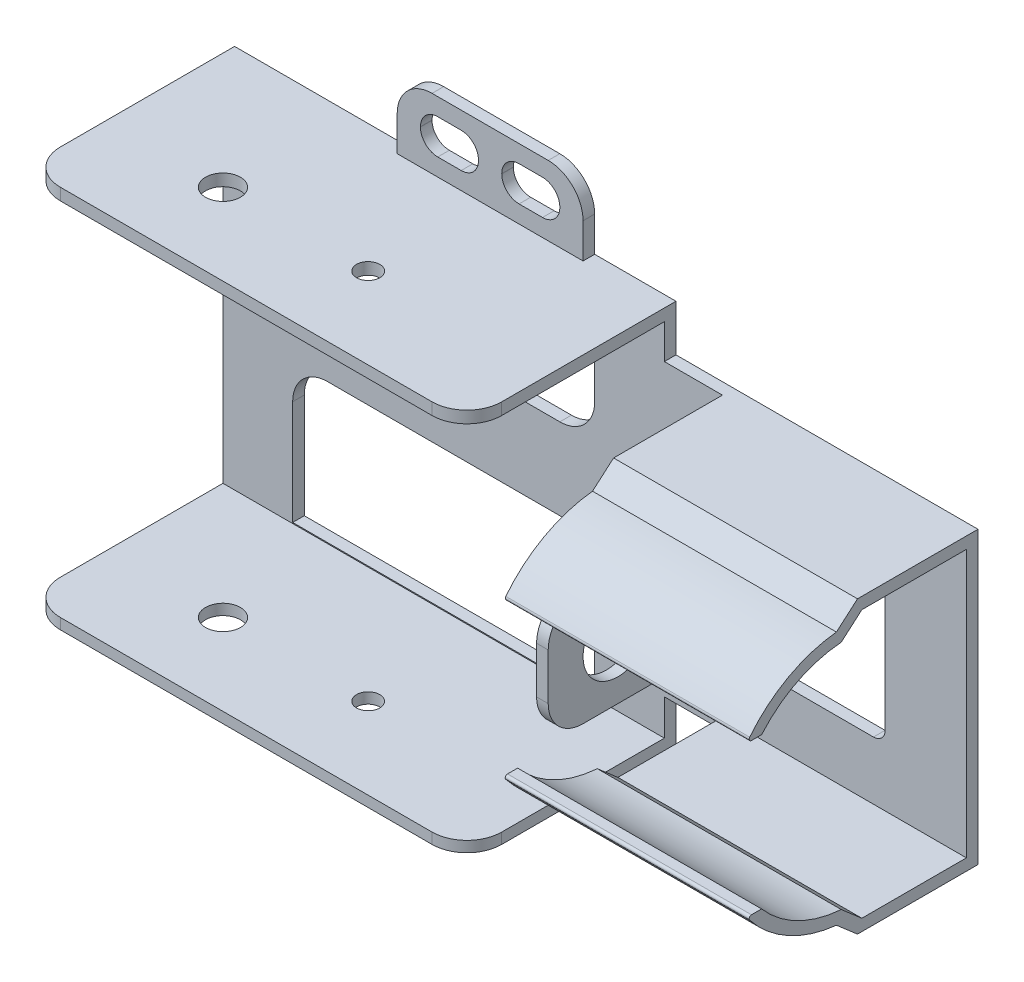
SolidWorks part; units mm, degrees
ref_plane "Plan de face" through (0, 0, 0) normal (0, 0, 1) x (1, 0, 0)
ref_plane "Plan de dessus" through (0, 0, 0) normal (0, 1, 0) x (1, 0, 0)
ref_plane "Plan de droite" through (0, 0, 0) normal (1, 0, 0) x (0, 0, -1)
sketch "Esquisse1" plane through (0, 0, 0) normal (0, 0, 1) x (1, 0, 0)
  line L0 (-30.9892, 6.739) -> (-30.9892, 10.739)
  line L1 (-77.8035, -5.761) -> (7.1636, -5.761) construction
  line L2 (-68.9892, 10.739) -> (-68.9892, -22.261)
  line L3 (-53.9892, 16.739) -> (-37.9892, 16.739)
  line L4 (-4.9892, 6.739) -> (-4.9892, -18.2523)
  line L5 (-30.9892, 6.739) -> (-4.9892, 6.739)
  line L6 (-30.9892, -18.2523) -> (-30.9892, -22.261)
  line L7 (-4.9892, -18.2523) -> (-30.9892, -18.2523)
  line L8 (-68.9892, 10.739) -> (-53.9892, 10.739)
  line L9 (-53.9892, -22.261) -> (-68.9892, -22.261)
  line L10 (-53.9892, 16.739) -> (-53.9892, 10.739)
  line L11 (-37.9892, -22.261) -> (-30.9892, -22.261)
  line L12 (-37.9892, 16.739) -> (-37.9892, 10.739)
  line L13 (-37.9892, -28.261) -> (-37.9892, -22.261)
  line L14 (-53.9892, -28.261) -> (-53.9892, -22.261)
  line L15 (-53.9892, -28.261) -> (-37.9892, -28.261)
  line L16 (-37.9892, 10.739) -> (-30.9892, 10.739)
  dimension "D1" = 64
  dimension "D2" = 7
  dimension "D3" = 26
  dimension "D4" = 4
  dimension "D6" = 16
  dimension "D7" = 6
  dimension "D9" = 16.5
extrude "Extrusion1" add sketch "Esquisse1" along normal blind 1
sketch "Esquisse3" plane through (0, 0, 1) normal (0, 0, 1) x (1, 0, 0)
  line L0 (-4.9892, -18.2523) -> (-4.9892, 6.739) construction
  line L1 (-24.9892, 0.739) -> (-11.9892, 0.739)
  line L2 (-62.9892, 9.7477) -> (-36.9892, 9.7477)
  line L3 (-24.9892, -12.2523) -> (-11.9892, -12.2523)
  line L4 (-11.9892, 0.739) -> (-11.9892, -12.2523)
  line L5 (-4.9892, 6.739) -> (-30.9892, 6.739) construction
  line L6 (-30.9892, -18.2523) -> (-4.9892, -18.2523) construction
  line L7 (-36.9892, -21.2523) -> (-62.9892, -21.2523)
  line L8 (-24.9892, 0.739) -> (-24.9892, -12.2523)
  line L13 (-68.9892, 10.739) -> (-68.9892, -22.261) construction
  line L15 (-62.9892, 9.7477) -> (-62.9892, -2.2523)
  line L16 (-62.9892, -2.2523) -> (-36.9892, -2.2523)
  line L17 (-36.9892, 9.7477) -> (-36.9892, -2.2523)
  line L18 (-30.9892, 6.739) -> (-30.9892, 10.739) construction
  line L20 (-77.6846, -5.7523) -> (9.9973, -5.7523) construction
  line L30 (-36.9892, -21.2523) -> (-36.9892, -9.2523)
  line L31 (-62.9892, -9.2523) -> (-36.9892, -9.2523)
  line L32 (-62.9892, -21.2523) -> (-62.9892, -9.2523)
  dimension "D1" = 7
  dimension "D2" = 13
  dimension "D3" = 6
  dimension "D4" = 6
  dimension "D6" = 6
  dimension "D7" = 6
extrude "Enlèv. mat.-Extru.1" cut sketch "Esquisse3" against normal blind 1
fillet "Congé2" radius 3 8 edges at (-37.9892, -28.261, 0.5) (-53.9892, -28.261, 0.5) (-53.9892, 16.739, 0.5) (-37.9892, 16.739, 0.5) (-62.9892, -2.2523, 0.5) (-36.9892, -2.2523, 0.5) (-36.9892, -9.2523, 0.5) (-62.9892, -9.2523, 0.5)
sketch "Esquisse14" plane through (0, 0, 1) normal (0, 0, 1) x (1, 0, 0)
  line L0 (-30.9892, 6.739) -> (-30.9892, 10.739) construction
  line L1 (-68.9892, 10.739) -> (-30.9892, 10.739)
  line L2 (-68.9892, 10.739) -> (-68.9892, 9.7177)
  line L3 (-68.9892, 9.7177) -> (-30.9892, 9.7177)
  line L4 (-30.9892, 10.739) -> (-30.9892, 9.7177)
  line L5 (-30.9892, -22.261) -> (-30.9892, -18.2523) construction
  line L6 (-68.9892, -22.261) -> (-30.9892, -22.261)
  line L7 (-68.9892, -22.261) -> (-68.9892, -21.3365)
  line L8 (-68.9892, -21.3365) -> (-30.9892, -21.3365)
  line L9 (-30.9892, -22.261) -> (-30.9892, -21.3365)
extrude "Extrusion2" add sketch "Esquisse14" along normal blind 17
fillet "Congé3" radius 3 4 edges at (-68.9892, 10.2284, 18) (-30.9892, 10.2284, 18) (-68.9892, -21.7987, 18) (-30.9892, -21.7987, 18)
sketch "Esquisse15" plane through (-4.9892, 0, 0) normal (1, 0, 0) x (0, 0, -1)
  line L0 (0, 6.739) -> (-10.3725, 6.739)
  line L3 (0, 6.739) -> (0, -18.261)
  line L7 (0, -18.261) -> (-10.3725, -18.261)
  line L9 (-10.3725, 6.739) -> (-12.187, 5.1692)
  line L10 (0, 6.739) -> (-10.3725, 6.739)
  line L12 (-10.3725, -18.261) -> (-12.187, -16.6912)
  line L16 (0, -18.261) -> (-10.3725, -18.261)
  arc A4 (-12.187, 5.1692) -> (-12.187, -16.6912) centre (-11.0375, -5.761) ccw
extrude "Extrusion3" add sketch "Esquisse15" against normal blind 21
sketch "Esquisse16" plane through (-4.9892, 0, 0) normal (1, 0, 0) x (0, 0, -1)
  line L10 (-1, -17.261) -> (-1, 5.739)
  line L11 (-10, -17.261) -> (-1, -17.261)
  line L12 (-11.7764, -15.7241) -> (-10, -17.261)
  line L13 (-10, 5.739) -> (-11.7764, 4.2021)
  line L14 (-1, 5.739) -> (-10, 5.739)
  line L15 (-1, -17.261) -> (-1, 5.739)
  line L16 (-10, -17.261) -> (-1, -17.261)
  line L17 (-11.7764, -15.7241) -> (-10, -17.261)
  line L18 (-10, 5.739) -> (-11.7764, 4.2021)
  line L19 (-1, 5.739) -> (-10, 5.739)
  arc A2 (-11.7764, 4.2021) -> (-11.7764, -15.7241) centre (-11.0375, -5.761) ccw
  arc A3 (-11.7764, 4.2021) -> (-11.7764, -15.7241) centre (-11.0375, -5.761) ccw
  dimension "D1" = 1
extrude "Enlèv. mat.-Extru.2" cut sketch "Esquisse16" against normal blind 30
sketch "Esquisse17" plane through (0, 0, 1) normal (0, 0, 1) x (1, 0, 0)
  line L0 (-25.9892, 6.739) -> (-30.9892, 6.739) construction
  line L1 (-29.0936, 0.739) -> (-1.0712, 0.739)
  line L2 (-29.0936, 0.739) -> (-29.0936, -12.2523)
  line L3 (-29.0936, -12.2523) -> (-1.0712, -12.2523)
  line L4 (-1.0712, 0.739) -> (-1.0712, -12.2523)
  line L6 (-30.9892, -18.2523) -> (-25.9892, -18.2523) construction
  dimension "D1" = 6
  dimension "D2" = 6
extrude "Enlèv. mat.-Extru.3" cut sketch "Esquisse17" along normal blind 30
fillet "Congé4" radius 0.2 2 edges at (-15.4892, -12.2523, 19.9062) (-15.4892, 0.739, 19.8999)
sketch "Esquisse18" plane through (0, 0, 1) normal (0, 0, 1) x (1, 0, 0)
  line L0 (-24.9892, 0.739) -> (-24.9892, -12.2523) construction
  line L1 (-24.9892, -0.761) -> (-25.9892, -0.761)
  line L2 (-24.9892, -0.761) -> (-24.9892, -10.761)
  line L3 (-24.9892, -10.761) -> (-25.9892, -10.761)
  line L4 (-25.9892, -0.761) -> (-25.9892, -10.761)
  dimension "D1" = 7.5
  dimension "D2" = 7.5
  dimension "D3" = 1
extrude "Extrusion4" add sketch "Esquisse18" along normal blind 16
fillet "Congé5" radius 3 2 edges at (-25.4892, -0.761, 17) (-25.4892, -10.761, 17)
sketch "Esquisse19" plane through (-25.9892, 0, 0) normal (-1, 0, 0) x (0, 0, 1)
  line L0 (1, -0.761) -> (1, -10.761) construction
  line L1 (14, -0.761) -> (1, -0.761) construction
  circle A0 centre (11, -5.761) radius 3
  dimension "D1" = 10
  dimension "D2" = 5
  dimension "D3" = 6
extrude "Enlèv. mat.-Extru.4" cut sketch "Esquisse19" against normal blind 16
fillet "Congé6" radius 1 4 edges at (-24.9892, -12.2523, 0.5) (-24.9892, 0.739, 0.5) (-11.9892, 0.739, 0.5) (-11.9892, -12.2523, 0.5)
sketch "Esquisse20" plane through (0, 10.739, 0) normal (0, 1, 0) x (-1, 0, 0)
  line L0 (53.9892, 0) -> (68.9892, 0) construction
  line L3 (68.9892, 15) -> (68.9892, 0) construction
  circle A0 centre (109.6643, 11.5857) radius 1.5517
  circle A1 centre (58.9892, 11) radius 1.5
  circle A2 centre (46.4892, 11) radius 1
  dimension "D2" = 10
  dimension "D3" = 12.5
  dimension "D4" = 3
  dimension "D5" = 2
  dimension "D1" = 11
extrude "Enlèv. mat.-Extru.7" cut sketch "Esquisse20" against normal blind 46
sketch "Esquisse22" plane through (0, 0, 1) normal (0, 0, 1) x (1, 0, 0)
  line L0 (-50.9892, -28.261) -> (-40.9892, -28.261) construction
  line L1 (-50.4992, -23.761) -> (-48.4792, -23.761)
  line L2 (-51.9892, -25.251) -> (-51.9892, -25.271)
  line L3 (-50.4992, -26.761) -> (-48.4792, -26.761)
  line L4 (-46.9892, -25.251) -> (-46.9892, -25.271)
  line L5 (-43.4992, -23.761) -> (-41.4792, -23.761)
  line L6 (-44.9892, -25.251) -> (-44.9892, -25.271)
  line L7 (-43.4992, -26.761) -> (-41.4792, -26.761)
  line L8 (-39.9892, -25.251) -> (-39.9892, -25.271)
  line L14 (-53.9892, -22.261) -> (-53.9892, -25.261) construction
  line L15 (-37.9892, -25.261) -> (-37.9892, -22.261) construction
  arc A0 (-51.9892, -25.251) -> (-50.4992, -23.761) centre (-50.4992, -25.251) cw
  arc A1 (-50.4992, -26.761) -> (-51.9892, -25.271) centre (-50.4992, -25.271) cw
  arc A2 (-46.9892, -25.271) -> (-48.4792, -26.761) centre (-48.4792, -25.271) cw
  arc A3 (-48.4792, -23.761) -> (-46.9892, -25.251) centre (-48.4792, -25.251) cw
  arc A4 (-44.9892, -25.251) -> (-43.4992, -23.761) centre (-43.4992, -25.251) cw
  arc A5 (-43.4992, -26.761) -> (-44.9892, -25.271) centre (-43.4992, -25.271) cw
  arc A6 (-39.9892, -25.271) -> (-41.4792, -26.761) centre (-41.4792, -25.271) cw
  arc A7 (-41.4792, -23.761) -> (-39.9892, -25.251) centre (-41.4792, -25.251) cw
  point P16 (-51.9892, -23.761)
  point P19 (-51.9892, -26.761)
  point P22 (-46.9892, -26.761)
  point P27 (-44.9892, -23.761)
  point P32 (-39.9892, -26.761)
  point P35 (-39.9892, -23.761)
  dimension "D9" = 1.49
  dimension "D1" = 5
  dimension "D2" = 3
  dimension "D3" = 5
  dimension "D4" = 3
  dimension "D5" = 1.5
  dimension "D6" = 1.5
  dimension "D7" = 2
  dimension "D8" = 2
extrude "Enlèv. mat.-Extru.9" cut sketch "Esquisse22" against normal through all
pattern_linear "Répétition linéaire1" count 2 spacing 39 along (0, 1, 0) of "Enlèv. mat.-Extru.9"
